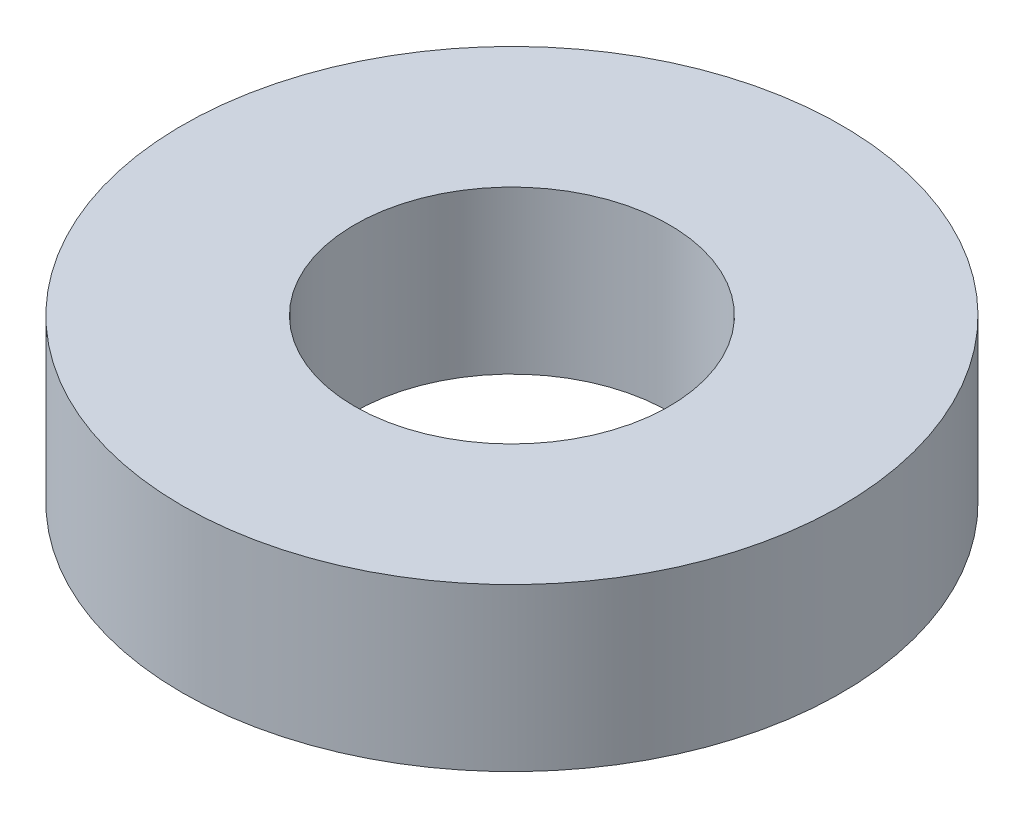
SolidWorks part; units mm, degrees
ref_plane "Front" through (0, 0, 0) normal (0, 0, 1) x (1, 0, 0)
ref_plane "Top" through (0, 0, 0) normal (0, 1, 0) x (1, 0, 0)
ref_plane "Right" through (0, 0, 0) normal (1, 0, 0) x (0, 0, -1)
sketch "Sketch1" plane through (0, 0, 0) normal (0, 1, 0) x (1, 0, 0)
  circle A0 centre (0, 0) radius 2.1463
  circle A1 centre (0, 0) radius 4.4958
  dimension "D1" = 4.2926
  dimension "D2" = 8.9916
extrude "Extrude1" add sketch "Sketch1" along normal blind 2.2098
